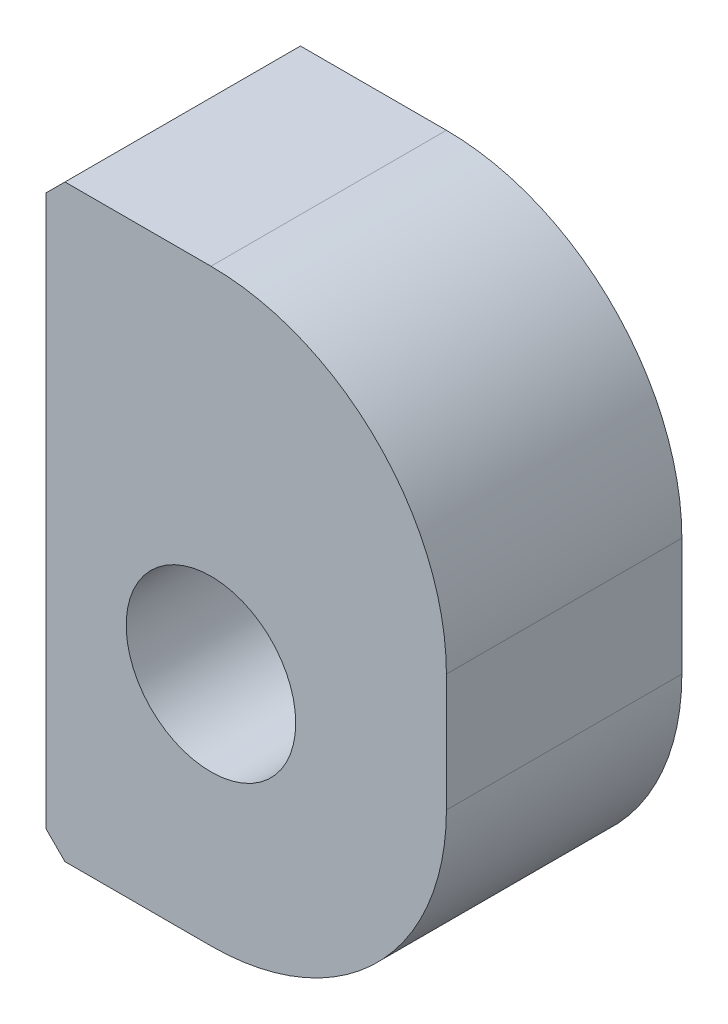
SolidWorks part; units mm, degrees
ref_plane "Front Plane" through (0, 0, 0) normal (0, 0, 1) x (1, 0, 0)
ref_plane "Top Plane" through (0, 0, 0) normal (0, 1, 0) x (1, 0, 0)
ref_plane "Right Plane" through (0, 0, 0) normal (1, 0, 0) x (0, 0, -1)
sketch "Sketch1" plane through (0, 0, 0) normal (0, 0, 1) x (1, 0, 0)
  line L3 (30, 10.514) -> (30, -50.5022)
  line L4 (30, -36.5) -> (21.5, -36.5)
  line L9 (30, -36.5) -> (30, -24)
  line L10 (30, -24) -> (21.5, -24)
  line L11 (21.5, -36.5) -> (21.5, -24)
  circle A4 centre (25, -31.5) radius 1.8
  dimension "D3" = 3.6
  dimension "D1" = 8.5
  dimension "D2" = 12.5
  dimension "D4" = 21.5
  dimension "D5" = 25
  dimension "D6" = 10.514
  dimension "D7" = 24
  dimension "D8" = 31.5
  dimension "D9" = 50.5022
extrude "Boss-Extrude1" add sketch "Sketch1" along normal blind 5
sketch "Sketch2" plane through (21.5, 0, 0) normal (-1, 0, 0) x (0, 0, 1)
  circle A0 centre (2.3812, -29.9041) radius 1.75 construction
  circle A1 centre (2.3812, -29.9041) radius 1.75
extrude "Cut-Extrude1" cut sketch "Sketch2" against normal blind 1
fillet "Fillet1" radius 5 2 edges at (30, -36.5, 2.5) (30, -24, 2.5)
chamfer "Chamfer1" distance 0.4 angle 45 3 edges at (21.5, -29.9041, 4.1312) (21.5, -24, 2.5) (21.5, -36.5, 2.5)
